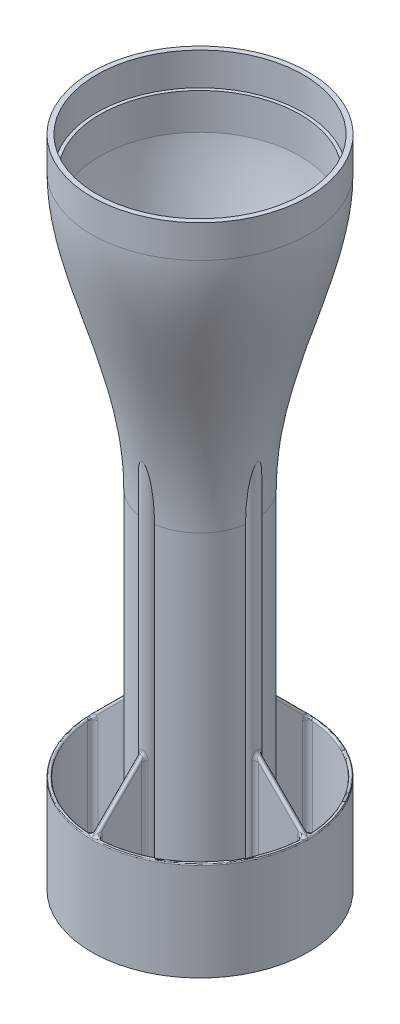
SolidWorks part; units mm, degrees
ref_plane "Front Plane" through (0, 0, 0) normal (0, 0, 1) x (1, 0, 0)
ref_plane "Top Plane" through (0, 0, 0) normal (0, 1, 0) x (1, 0, 0)
ref_plane "Right Plane" through (0, 0, 0) normal (1, 0, 0) x (0, 0, -1)
sketch "Sketch2" plane through (0, 0, 0) normal (0, 0, 1) x (1, 0, 0)
  line L0 (0, -1000) -> (0, 49000) construction
  line L1 (33.1, 10) -> (33.1, 0)
  line L2 (16.5, -83.9106) -> (16.5, -190)
  line L3 (16.5, -190) -> (15, -190)
  line L4 (33.1, 45.1465) -> (33.1, -45.1474) construction
  line L5 (16.5, -40.478) -> (16.5, -118.9496) construction
  line L6 (31.6, 10) -> (31.6, 0)
  line L11 (15, -83.9106) -> (15, -190)
  line L12 (15, -188.5) -> (8.1, -188.5) construction
  line L13 (15, -83.9106) -> (15, -188.5) construction
  line L14 (16.5, -190) -> (8.1, -190) construction
  line L15 (31.6, 10) -> (33.1, 10)
  line L19 (15, -42.4) -> (15, -83.9106)
  line L24 (15, -42.4) -> (19, -42.4)
  line L25 (19, -42.4) -> (19, -40)
  line L26 (19, -40) -> (22.8741, -40)
  line L27 (31.6, 0) -> (30.6, 0)
  line L28 (30.6, 0) -> (30.6, -11.0593)
  arc A2 (6.8262, 33.4655) -> (31.6, 10) centre (8.1, 10) cw construction
  arc A3 (6.7449, 34.9632) -> (33.1, 10) centre (8.1, 10) cw construction
  spline S0 degree 3 poles (16.5, -83.9106) (16.5, -50.7882) (33.1, -24.7214) (33.1, 0) knots 0 0 0 0 1 1 1 1
  spline S1 degree 1 poles (15, -83.9106) (31.6, 0) knots 0 0 1 1 construction
  spline S2 degree 3 poles (31.6, 0) (31.6, -1.5131) (31.4792, -4.3943) (31.1115, -7.7112) (30.7338, -10.2827) (30.1878, -13.5173) (28.8797, -19.5527) (26.5595, -27.8936) (24.0798, -35.9859) (21.9952, -42.9154) (19.869, -50.346) (17.9533, -58.0589) (16.5112, -65.7167) (15.6741, -71.6102) (15.2221, -76.6566) (15.0329, -80.7696) (15, -82.8669) (15, -83.9106) knots 0 0 0 0 0.0625 0.119724 0.135349 0.166599 0.25 0.375 0.488398 0.550898 0.625 0.75 0.8125 0.875 0.9375 0.96875 1 1 1 1 only from (30.6, -11.0593) to (22.8741, -40)
  dimension "D1" = 30
  dimension "D2" = 66.2
  dimension "D3" = 10
  dimension "D6" = 40
  dimension "D7" = 1
  dimension "D12" = 38
  dimension "D13" = 2.4
  dimension "D5" = 1.5
revolve "Revolve2" add sketch "Sketch2" angle 360 about L0
sketch "Sketch8" plane through (0, 0, 0) normal (0, 0, 1) x (1, 0, 0)
  line L0 (-16.5, -190) -> (-33.1, -190)
  line L1 (-33.1, -190) -> (-33.1, -160)
  line L2 (-33.1, -160) -> (-15.75, -142.65)
  line L4 (-16.5, -190) -> (-16.5, -143.4) construction
  line L6 (-16.5, -190) -> (-15.75, -190)
  line L7 (-15.75, -190) -> (-15.75, -142.65)
  line L8 (-16.5, -190) -> (-15, -190) construction
  dimension "D1" = 135
  dimension "D3" = 30
extrude "Boss-Extrude7" add sketch "Sketch8" along normal mid plane 1.5 contours L6 L7 L2 L1 L0
sketch "Sketch14" plane through (0, -190, 0) normal (0, -1, 0) x (1, 0, 0)
  circle A0 centre (-15, 0) radius 1
  circle A2 centre (0, 0) radius 15 construction
  dimension "D1" = 2
extrude "Cut-Extrude4" cut sketch "Sketch14" against normal through all
pattern_circular "CirPattern7" count 4 over 360 about axis through (0, 0, 0) along (0, 1, 0) of "Boss-Extrude7", "Cut-Extrude4"
sketch "Sketch11" plane through (0, 0, 0) normal (0, 0, 1) x (1, 0, 0)
  line L0 (-33.1, -160) -> (-33.1, -190)
  line L1 (-33.1, -190) -> (-32.1, -190)
  line L3 (-32.1, -190) -> (-32.1, -159)
  line L5 (-32.1, -159) -> (-33.1, -160)
  line L8 (-33.1, -160) -> (-16.4829, -143.3829) construction
  dimension "D1" = 1
revolve "Revolve3" add sketch "Sketch11" angle 360 about L0
sketch "Sketch13" plane through (0, 0, 0) normal (0, 0, 1) x (1, 0, 0)
  line L0 (-33.1, -195.1124) -> (-33.1, -160)
  line L1 (-33.1, -160) -> (-16.5, -143.4)
  line L3 (-36.45, -90.4746) -> (-36.45, -195.1124)
  line L4 (-36.45, -195.1124) -> (-33.1, -195.1124)
  line L5 (-16.5, -143.4) -> (-16.5, -90.4746)
  line L6 (-16.5, -90.4746) -> (-36.45, -90.4746)
revolve "Cut-Revolve1" cut sketch "Sketch13" angle 360 about L0
fillet "Fillet8" radius 0.5 5 edges at (33.1, -160, 0) (22.6981, -159, -22.6981) (22.6981, -159, 22.6981) (-22.6981, -159, 22.6981) (-22.6981, -159, -22.6981)
sketch "Sketch23" plane through (0, -190, 0) normal (0, -1, 0) x (1, 0, 0)
  line L0 (-14.9667, 0.9994) -> (-14.9083, 2.7485)
  line L1 (-14.9667, -0.9994) -> (-14.9083, -2.7485)
  arc A24 (-14.9083, 2.7485) -> (-14.9083, -2.7485) centre (-15, 0) ccw
  arc A25 (-14.9083, 2.7485) -> (-14.9083, -2.7485) centre (-15, 0) ccw
  arc A27 (-14.9667, 0.9994) -> (-14.9667, -0.9994) centre (-15, 0) ccw
  arc A28 (-14.9667, 0.9994) -> (-14.9667, -0.9994) centre (-15, 0) ccw
  dimension "D1" = 1.75
  dimension "D2" = 0
extrude "Boss-Extrude9" add sketch "Sketch23" against normal up to next
pattern_circular "CirPattern9" count 4 over 360 about axis through (0, 0, 0) along (0, 1, 0) of "Boss-Extrude9"
fillet "Fillet10" radius 0.75 8 edges
fillet "Fillet11" radius 1.5 40 edges at (-32.3677, -159.7611, -0.6337) (-32.3677, -159.7611, 0.6337) (-0.6337, -159.7611, 32.3677) (0.6337, -159.7611, 32.3677) (32.3677, -159.7611, 0.6337) (32.3677, -159.7611, -0.6337) (0.6337, -159.7611, -32.3677) (-0.6337, -159.7611, -32.3677) (-32.0912, -175.1036, -0.75) (-32.0912, -175.1036, 0.75) (-0.75, -175.1036, 32.0912) (0.75, -175.1036, 32.0912) (32.0912, -175.1036, 0.75) (32.0912, -175.1036, -0.75) (0.75, -175.1036, -32.0912) (-0.75, -175.1036, -32.0912) (-17.6458, -167.8032, -0.75) (-17.6907, -144.9587, -0.568) (-17.7191, -144.7925, 0.4109) (-0.75, -167.8032, 17.6458) (-0.568, -144.9587, 17.6907) (0.4109, -144.7925, 17.7191) (17.6458, -167.8032, 0.75) (17.6907, -144.9587, 0.568) (17.7191, -144.7925, -0.4109) (-0.75, -167.8032, -17.6458) (-0.4109, -144.7925, -17.7191) (0.568, -144.9587, -17.6907) (-17.6458, -167.8032, 0.75) (0.75, -167.8032, 17.6458) (17.6458, -167.8032, -0.75) (0.75, -167.8032, -17.6458)
